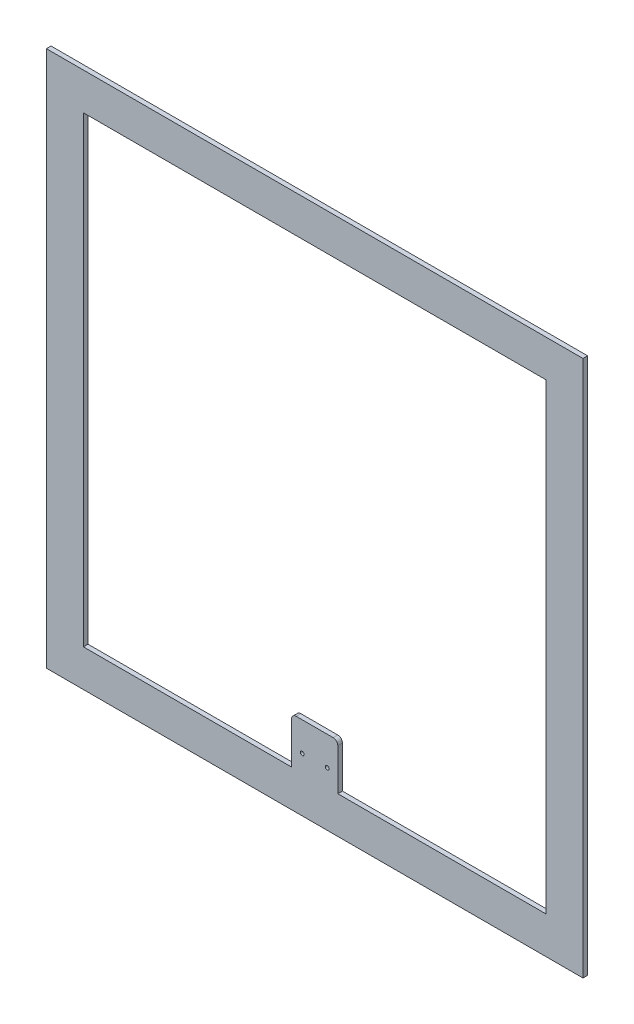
SolidWorks part; units mm, degrees
ref_plane "Front" through (0, 0, 0) normal (0, 0, 1) x (1, 0, 0)
ref_plane "Top" through (0, 0, 0) normal (0, 1, 0) x (1, 0, 0)
ref_plane "Right" through (0, 0, 0) normal (1, 0, 0) x (0, 0, -1)
sketch "Esquisse1" plane through (0, 0, 0) normal (0, 0, 1) x (1, 0, 0)
  line L0 (0, 0) -> (0, -290) construction
  line L1 (-250, 250) -> (250, 250)
  line L2 (-250, 250) -> (-250, -250)
  line L3 (-250, -250) -> (-25, -250)
  line L4 (250, 250) -> (250, -250)
  line L5 (-250, 250) -> (250, -250) construction
  line L6 (-250, -250) -> (250, 250) construction
  line L7 (-290, 290) -> (290, 290)
  line L8 (-290, 290) -> (-290, -290)
  line L9 (-290, -290) -> (290, -290)
  line L10 (290, 290) -> (290, -290)
  line L11 (-290, 290) -> (290, -290) construction
  line L12 (-290, -290) -> (290, 290) construction
  line L13 (25, -250) -> (250, -250)
  line L14 (-25, -200) -> (25, -200)
  line L15 (-25, -200) -> (-25, -250)
  line L17 (25, -200) -> (25, -250)
  line L18 (-25, -200) -> (25, -250) construction
  line L19 (-25, -250) -> (25, -200) construction
  point P0 (0, 0)
  point P6 (0, 0)
  point P13 (0, -225)
  dimension "D1" = 500
  dimension "D2" = 500
  dimension "D3" = 40
  dimension "D4" = 40
  dimension "D5" = 50
  dimension "D6" = 50
extrude "Boss.-Extru.1" add sketch "Esquisse1" along normal blind 5
sketch "Esquisse2" plane through (0, 0, 5) normal (0, 0, 1) x (1, 0, 0)
  line L0 (0, -290) -> (0, -200) construction
  line L1 (-290, -290) -> (290, -290) construction
  line L3 (0, -231.5) -> (-13.5, -231.5) construction
  line L4 (-25, -200) -> (25, -200) construction
  line L5 (-250, -250) -> (-25, -250) construction
  circle A0 centre (-13.5, -231.5) radius 2
  circle A1 centre (13.5, -231.5) radius 2
  dimension "D2" = 4
  dimension "D1" = 13.5
  dimension "D3" = 18.5
extrude "Enlèv. mat.-Extru.1" cut sketch "Esquisse2" against normal up to next
fillet "Congé1" radius 5 2 edges at (25, -200, 2.5) (-25, -200, 2.5)
ref_plane "Plan1" through (0, 0, 2.5) normal (0, 0, -1) x (-1, 0, 0)
sketch "Esquisse3" plane through (0, 0, 2.5) normal (0, 0, -1) x (-1, 0, 0)
  point P0 (0, 0)
